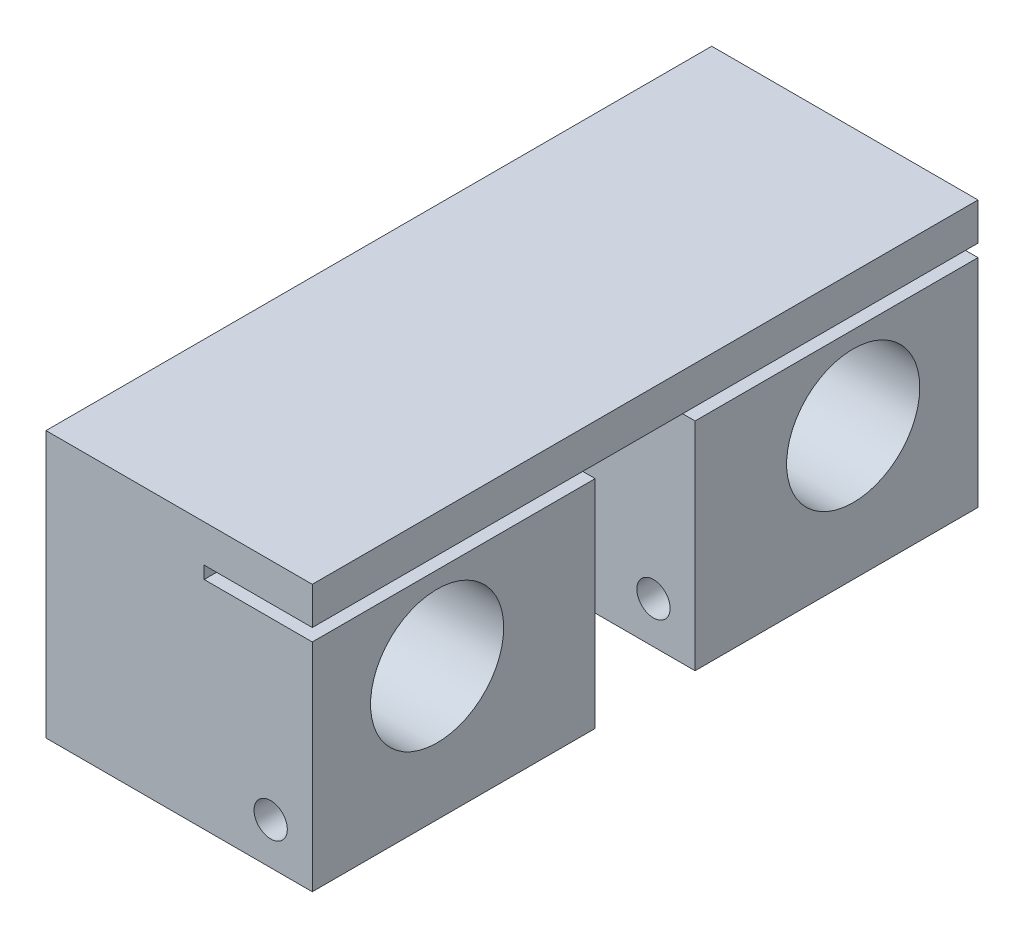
SolidWorks part; units mm, degrees
ref_plane "Plan1" through (0, 0, 0) normal (0, 0, 1) x (1, 0, 0)
ref_plane "Plan2" through (0, 0, 0) normal (0, 1, 0) x (1, 0, 0)
ref_plane "Plan3" through (0, 0, 0) normal (1, 0, 0) x (0, 0, -1)
sketch "Esquisse1" plane through (0, 0, 0) normal (0, 0, 1) x (1, 0, 0)
  line L0 (0, 0) -> (16, 0)
  line L1 (0, 0) -> (0, 16)
  line L2 (16, 16) -> (0, 16)
  line L3 (16, 16) -> (16, 0)
  dimension "D1" = 16
  dimension "D2" = 16
extrude "brut" add sketch "Esquisse1" along normal blind 40
sketch "Esquisse3" plane through (16, 0, 0) normal (1, 0, 0) x (0, 0, -1)
  line L0 (-40, 16) -> (-40, 0) construction
  line L1 (-40, 0) -> (0, 0) construction
  line L2 (-20, 20) -> (-20, 0) construction
  line L3 (0, 16) -> (0, 0) construction
  circle A0 centre (-32.5, 8) radius 4
  circle A1 centre (-7.5, 8) radius 4
  dimension "D1" = 8
  dimension "D2" = 7.5
  dimension "D3" = 8
  dimension "D4" = 20
extrude "perçage 1" cut sketch "Esquisse3" against normal through all
sketch "Esquisse5" plane through (0, 0, 0) normal (0, -1, 0) x (1, 0, 0)
  line L0 (0, 0) -> (16, 0) construction
  line L1 (0, 40) -> (0, 0) construction
  line L2 (16, 23) -> (4.5, 23)
  line L3 (16, 40) -> (16, 0) construction
  line L4 (4.5, 17) -> (16, 17)
  line L5 (16, 23) -> (16, 17)
  arc A0 (4.5, 23) -> (4.5, 17) centre (4.5, 20) ccw
  dimension "D1" = 6
  dimension "D2" = 20
  dimension "D3" = 4.5
extrude "rainure" cut sketch "Esquisse5" against normal blind 13
sketch "Esquisse6" plane through (16, 0, 0) normal (1, 0, 0) x (0, 0, -1)
  line L0 (-40, 13) -> (0, 13)
  line L1 (-40, 16) -> (-40, 0) construction
  line L2 (0, 16) -> (0, 0) construction
  line L3 (-40, 13.75) -> (0, 13.75)
  line L4 (-40, 13) -> (-40, 13.75)
  line L5 (0, 13) -> (0, 13.75)
  dimension "D1" = 0.75
extrude "saignée" cut sketch "Esquisse6" against normal blind 6.5
sketch "Esquisse7" plane through (0, 0, 40) normal (0, 0, 1) x (1, 0, 0)
  line L0 (0, 0) -> (0, 16) construction
  line L1 (0, 0) -> (16, 0) construction
  circle A0 centre (13.5, 2.5) radius 1
  dimension "D1" = 2
  dimension "D2" = 13.5
  dimension "D3" = 2.5
extrude "perçage" cut sketch "Esquisse7" against normal through all
hole_wizard "Perçage taraudage1" positions "Esquisse10" profile "Esquisse9" legacy
sketch "Esquisse10" plane through (0, 0, 0) normal (-1, 0, 0) x (0, 0, 1)
  line L0 (40, 0) -> (0, 0) construction
  point P0 (26, 12)
  dimension "D1" = 12
  dimension "D2" = 14
sketch "Esquisse9" plane through (0, 12, 26) normal (0, 1, 0) x (0, 0, 1)
  line L0 (0, 0) -> (0, 8.4013)
  line L1 (0, 8.4013) -> (1.5, 7.5)
  line L2 (1.5, 7.5) -> (1.5, 0)
  line L4 (1.5, 0) -> (0, 0)
  line L6 (0, 8.4013) -> (-1.5, 7.5) construction
  line L7 (0, -4.2442) -> (0, 117.3081) construction
  dimension "Diamètre" = 3
  dimension "Profondeur" = 7.5
  dimension "Angle" = 118
pattern_linear "Répétition linéaire1" count 2 spacing 12
pattern_linear "Répétition linéaire2" count 2 spacing 8
sketch "point d'encrage" plane through (0, 0, 0) normal (-1, 0, 0) x (0, 0, 1)
  line L0 (40, 16) -> (0, 16) construction
  line L1 (40, 0) -> (40, 16) construction
  point P0 (20, 8)
  dimension "D1" = 8
  dimension "D2" = 20
